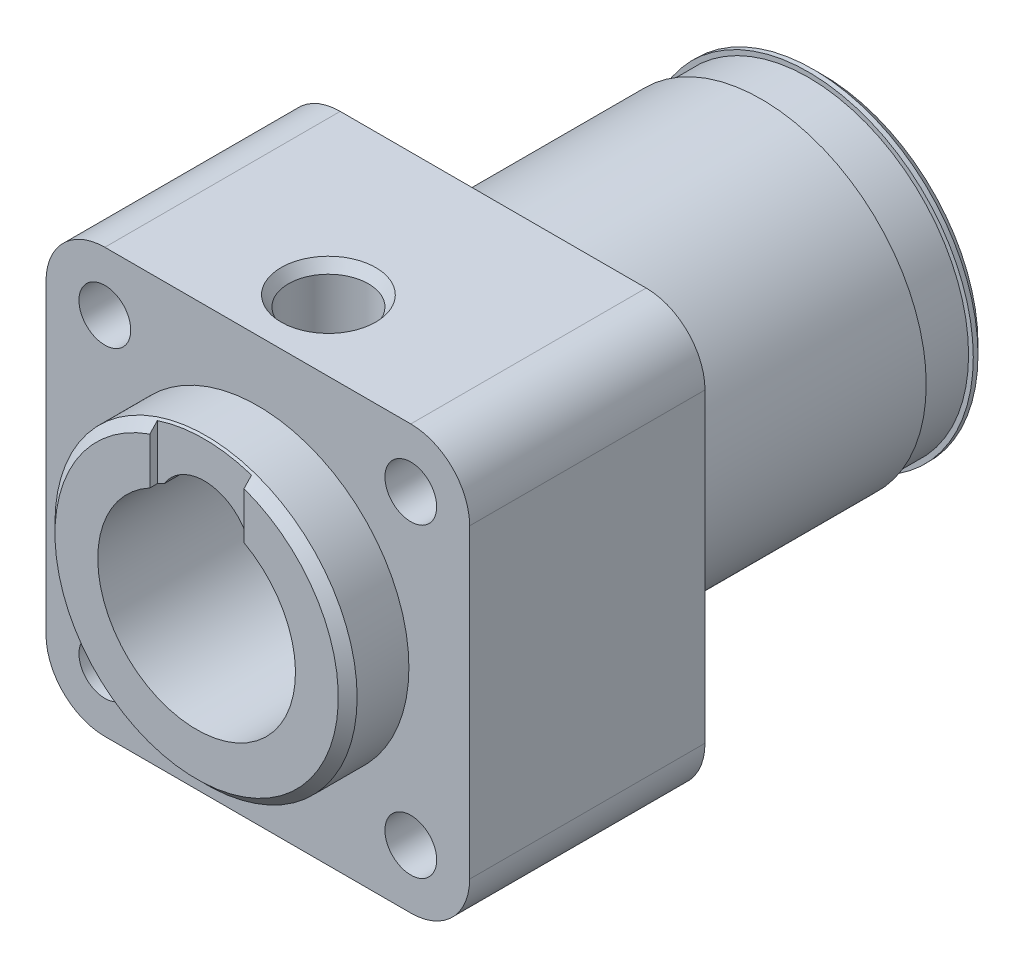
SolidWorks part; units mm, degrees
ref_plane "Face" through (0, 0, 0) normal (0, 0, 1) x (1, 0, 0)
ref_plane "Dessus" through (0, 0, 0) normal (0, 1, 0) x (1, 0, 0)
ref_plane "Droite" through (0, 0, 0) normal (1, 0, 0) x (0, 0, -1)
sketch "Esquisse1" plane through (0, 0, 0) normal (0, 0, 1) x (1, 0, 0)
  circle A0 centre (0, 0) radius 30
  dimension "D1" = 60
extrude "Boss.-Extru.1" add sketch "Esquisse1" along normal blind 66.5
sketch "Esquisse2" plane through (0, 0, 0) normal (1, 0, 0) x (0, 0, -1)
  line L0 (-66.5, 0) -> (12.8502, 0)
  line L1 (-66.5, 30) -> (-66.5, -30) construction
  line L2 (0, -30) -> (0, 30) construction
  line L3 (12.8502, 17.5) -> (-35, 17.5)
  line L4 (-35, 17.5) -> (-35, 33.4221)
  line L5 (-35, 33.4221) -> (12.8502, 33.4221)
  line L6 (12.8502, 33.4221) -> (12.8502, 17.5)
  line L7 (-6.5, 17.5) -> (-6.5, 17)
  line L8 (-6.5, 17) -> (-1.5, 17)
  line L9 (-1.5, 17) -> (-1.5, 17.5)
  dimension "D1" = 17.5
  dimension "D2" = 35
  dimension "D3" = 1.5
  dimension "D4" = 5
  dimension "D5" = 17
revolve "Enlèvement de matière-Révolution1" cut sketch "Esquisse2" angle 360 about L0
hole_wizard "Diamètre du perçage Ø21.0 (21)1" positions "Esquisse4" profile "Esquisse3" hole size "Ø21.0" standard "ISO"
sketch "Esquisse4" plane through (0, 0, 0) normal (0, 0, -1) x (-1, 0, 0)
  point P0 (0, 0)
sketch "Esquisse3" plane through (0, 0, 0) normal (1, 0, 0) x (0, 1, 0)
  line L0 (0, 0) -> (0, 66.5)
  line L1 (0, 66.5) -> (10.5, 66.5)
  line L2 (10.5, 66.5) -> (10.5, 0)
  line L5 (10.5, 0) -> (0, 0)
  line L11 (0, -6.35) -> (0, 107.95) construction
  dimension "Diamètre du perçage jusqu'au prochain" = 21
  dimension "Profondeur du perçage jusqu'au prochain" = 66.5
sketch "Esquisse5" plane through (0, 0, 0) normal (0, 0, -1) x (-1, 0, 0)
  circle A0 centre (0, 0) radius 14.5
  dimension "D1" = 29
extrude "Enlèv. mat.-Extru.1" cut sketch "Esquisse5" against normal blind 32
chamfer "Chanfrein1" distance 1 angle 45 1 edges at (17.5, 0, 0)
sketch "Esquisse8" plane through (0, 0, 66.5) normal (0, 0, 1) x (1, 0, 0)
  circle A0 centre (0, 0) radius 16.05
  circle A1 centre (0, 0) radius 36.2394
  dimension "D1" = 32.1
extrude "Enlèv. mat.-Extru.2" cut sketch "Esquisse8" against normal blind 6.5
chamfer "Chanfrein2" distance 1 angle 45 1 edges at (16.05, 0, 66.5)
sketch "Esquisse9" plane through (0, 0, 60) normal (0, 0, 1) x (1, 0, 0)
  line L0 (0, 0) -> (0, 31.8903) construction
  line L1 (-16.25, 22.5) -> (16.25, 22.5)
  line L2 (-22.5, 16.25) -> (-22.5, -16.25)
  line L3 (-16.25, -22.5) -> (16.25, -22.5)
  line L4 (22.5, 16.25) -> (22.5, -16.25)
  line L5 (0, 0) -> (47.0732, 0) construction
  line L7 (-44.6751, 47.3093) -> (43.8322, 47.3093)
  line L8 (-44.6751, 47.3093) -> (-44.6751, -45.202)
  line L9 (-44.6751, -45.202) -> (43.8322, -45.202)
  line L10 (43.8322, 47.3093) -> (43.8322, -45.202)
  arc A0 (-22.5, -16.25) -> (-16.25, -22.5) centre (-16.25, -16.25) ccw
  arc A1 (16.25, -22.5) -> (22.5, -16.25) centre (16.25, -16.25) ccw
  arc A2 (22.5, 16.25) -> (16.25, 22.5) centre (16.25, 16.25) ccw
  arc A3 (-16.25, 22.5) -> (-22.5, 16.25) centre (-16.25, 16.25) ccw
  point P13 (22.5, -22.5)
  point P16 (22.5, 22.5)
  point P19 (-22.5, 22.5)
  dimension "D5" = 6.25
  dimension "D1" = 22.5
  dimension "D2" = 22.5
  dimension "D3" = 45
  dimension "D4" = 45
extrude "Enlèv. mat.-Extru.3" cut sketch "Esquisse9" against normal blind 28.5
hole_wizard "Dégagement M51" positions "Esquisse11" profile "Esquisse12" hole size "M5" standard "ISO"
sketch "Esquisse11" plane through (0, 0, 60) normal (0, 0, 1) x (1, 0, 0)
  line L2 (-22.5, 16.25) -> (-22.5, -16.25) construction
  point P0 (-16.25, 16.25)
  point P1 (16.25, 16.25)
  point P4 (16.25, -16.25)
  point P7 (-16.25, -16.25)
  dimension "D1" = 6.25
sketch "Esquisse12" plane through (-16.25, 16.25, 60) normal (1, 0, 0) x (0, -1, 0)
  line L0 (0, 0) -> (0, 60)
  line L1 (0, 60) -> (2.75, 60)
  line L2 (2.75, 60) -> (2.75, 0)
  line L5 (2.75, 0) -> (0, 0)
  line L11 (0, -6.35) -> (0, 107.95) construction
  dimension "Diamètre du perçage jusqu'au prochain" = 5.5
  dimension "Profondeur du perçage jusqu'au prochain" = 60
hole_wizard "Trou taraudé M101" positions "Esquisse14" profile "Esquisse15" tap size "M10" standard "ISO"
sketch "Esquisse14" plane through (0, 22.5, 0) normal (0, 1, 0) x (-1, 0, 0)
  line L0 (-16.5, 0) -> (16.5, 0) construction
  point P0 (0, 52.5)
  dimension "D1" = 52.5
sketch "Esquisse15" plane through (0, 22.5, 52.5) normal (1, 0, 0) x (0, 0, 1)
  line L0 (0, 0) -> (0, 20.0537)
  line L1 (0, 20.0537) -> (4.25, 17.5)
  line L2 (4.25, 17.5) -> (4.25, 1.1068)
  line L3 (4.25, 1.1068) -> (5.025, 0)
  line L5 (5.025, 0) -> (0, 0)
  line L6 (-4.25, 1.1068) -> (-5.025, 0) construction
  line L10 (0, 20.0537) -> (-4.25, 17.5) construction
  line L11 (0, -6.35) -> (0, 107.95) construction
  dimension "Diamètre du trou pour taraudage" = 8.5
  dimension "Profondeur du trou pour taraudage" = 17.5
  dimension "Diamètre du fraisage entrant" = 10.05
  dimension "Angle du fraisage entrant" = 70
  dimension "Angle de pointe" = 118
sketch "Esquisse16" plane through (0, 0, 66.5) normal (0, 0, 1) x (1, 0, 0)
  line L0 (0, 0) -> (0, 27.8948) construction
  line L1 (-4.25, 9.6014) -> (4.3046, 9.5771)
  arc A0 (-4.25, 9.6014) -> (4.3046, 9.5771) centre (0.0199, 7) cw
  circle A1 centre (0, 0) radius 10.5 construction
  dimension "D2" = 5
  dimension "D1" = 7
extrude "Enlèv. mat.-Extru.4" cut sketch "Esquisse16" against normal blind 19
sketch "Esquisse17" plane through (0, 0, 66.5) normal (0, 0, 1) x (1, 0, 0)
  line L0 (0.0299, 10.5) -> (0.0299, 18.2865) construction
  line L1 (-4.9701, 7.989) -> (5.0299, 7.989)
  line L2 (-4.9701, 7.989) -> (-4.9701, 16.9074)
  line L3 (-4.9701, 16.9074) -> (5.0299, 16.9074)
  line L4 (5.0299, 7.989) -> (5.0299, 16.9074)
  arc A0 (4.3046, 9.5771) -> (-4.25, 9.6014) centre (0, 0) ccw construction
  dimension "D1" = 10
  dimension "D2" = 5
extrude "Enlèv. mat.-Extru.5" cut sketch "Esquisse17" against normal blind 0.8
